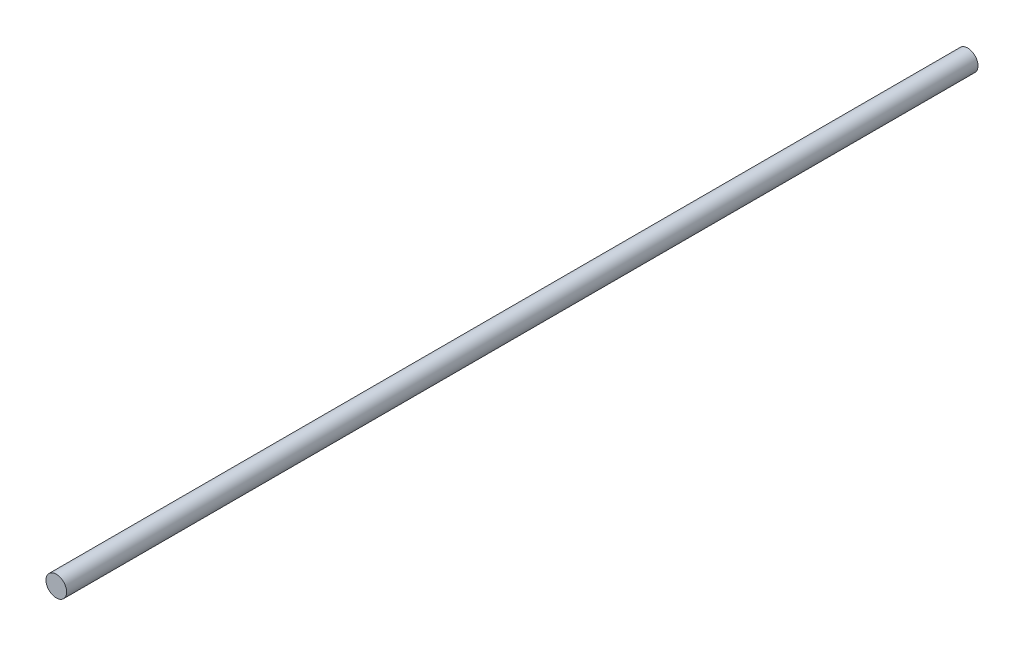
SolidWorks part; units mm, degrees
ref_plane "Front Plane" through (0, 0, 0) normal (0, 0, 1) x (1, 0, 0)
ref_plane "Top Plane" through (0, 0, 0) normal (0, 1, 0) x (1, 0, 0)
ref_plane "Right Plane" through (0, 0, 0) normal (1, 0, 0) x (0, 0, -1)
sketch "Sketch1" plane through (0, 0, 0) normal (0, 0, 1) x (1, 0, 0)
  circle A0 centre (0, 0) radius 30
  dimension "D1" = 60
extrude "Boss-Extrude1" add sketch "Sketch1" against normal blind 2650
